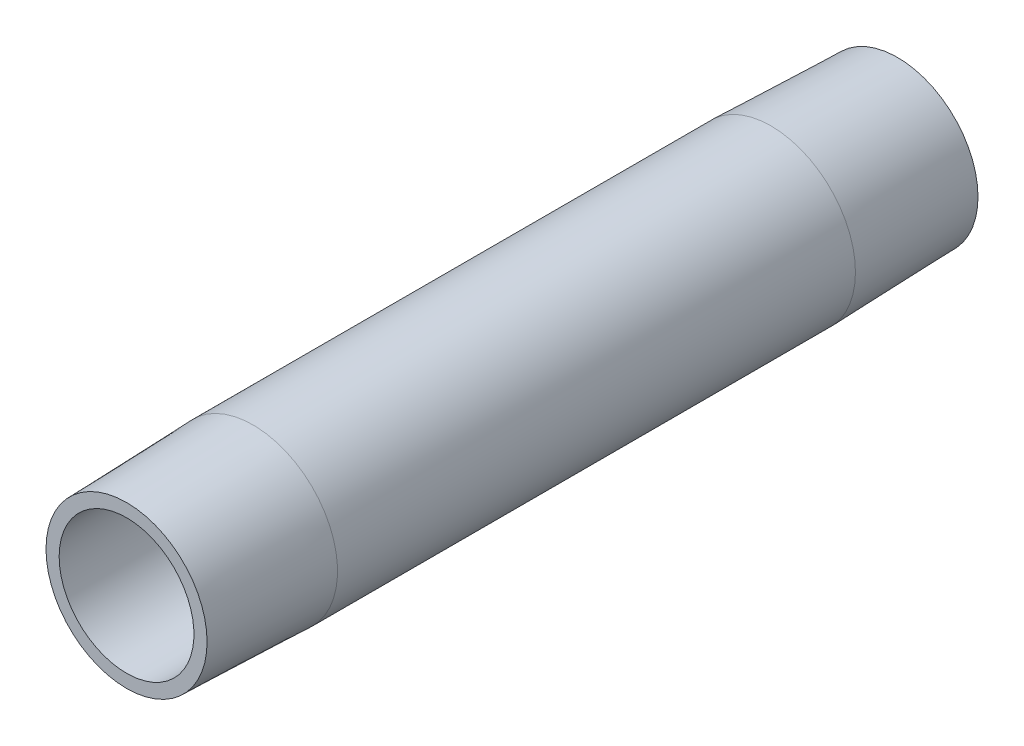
SolidWorks part; units mm, degrees
ref_plane "Front" through (0, 0, 0) normal (0, 0, 1) x (1, 0, 0)
ref_plane "Top" through (0, 0, 0) normal (0, 1, 0) x (1, 0, 0)
ref_plane "Right" through (0, 0, 0) normal (1, 0, 0) x (0, 0, -1)
sketch "PipeSketch" plane through (0, 0, 0) normal (0, 0, 1) x (1, 0, 0)
  circle A0 centre (0, 0) radius 16.7005
  circle A1 centre (0, 0) radius 13.3223
  dimension "OuterDiameter" = 33.401
  dimension "InnerDiameter" = 26.6446
extrude "Extrusion" add sketch "PipeSketch" along normal blind 152.4
sketch "ThdSketch" plane through (0, 0, 0) normal (1, 0, 0) x (0, 0, -1)
  line L0 (-152.4, 0) -> (0, 0) construction
  line L1 (-152.4, 0) -> (0, 0) construction
  line L2 (-127.3937, 16.7005) -> (-152.4, 15.9219)
  line L3 (0, 16.7005) -> (-152.4, 16.7005) construction
  line L4 (-152.4, 16.7005) -> (-152.4, -16.7005) construction
  line L5 (-152.4, 15.9219) -> (-152.4, 16.7005)
  line L6 (-152.4, 16.7005) -> (-127.3937, 16.7005)
  line L7 (0, -16.7005) -> (0, 16.7005) construction
  line L8 (-76.2, 0) -> (-76.2, 9.1165) construction
  line L9 (0, 16.7005) -> (-25.0063, 16.7005)
  line L10 (0, 15.9219) -> (0, 16.7005)
  line L11 (-25.0063, 16.7005) -> (0, 15.9219)
  dimension "L4" = 25.0063
  dimension "D2" = 1.783
revolve "Thread" cut sketch "ThdSketch" angle 360 about L0
sketch "FilterSketch" plane through (0, 0, 0) normal (0, 0, 1) x (1, 0, 0)
  circle A0 centre (0, 0) radius 12.7
  dimension "NominalDiameter" = 25.4
